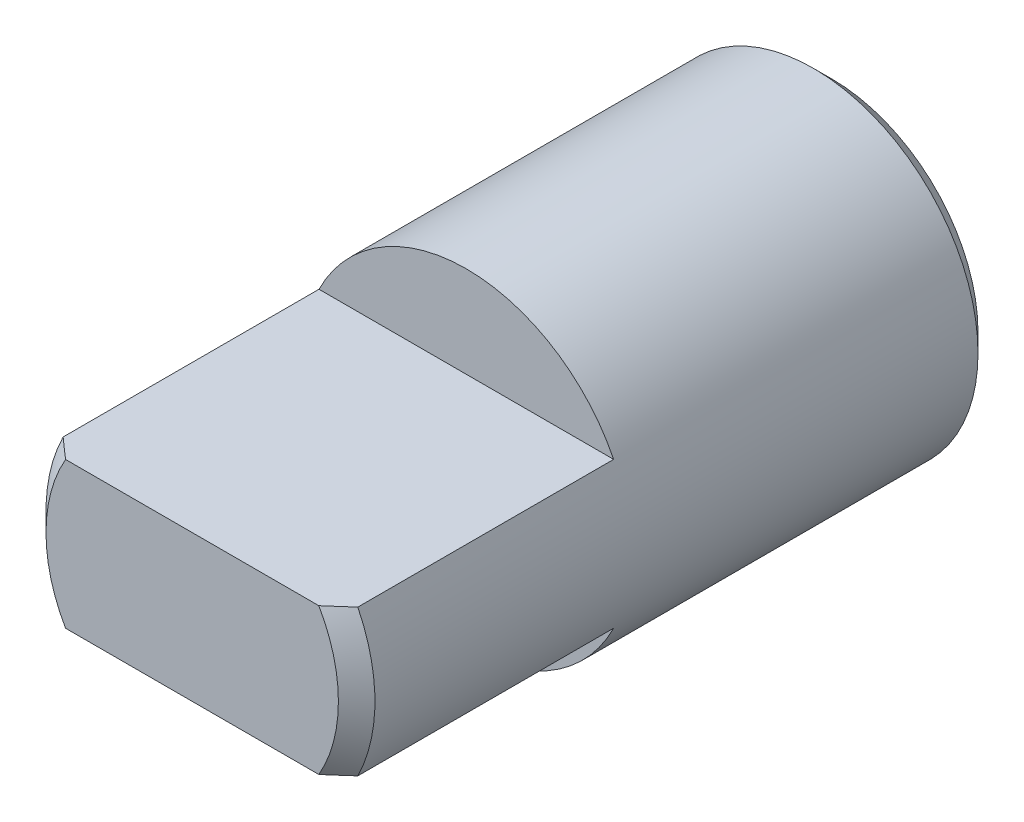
SolidWorks part; units mm, degrees
ref_plane "Face" through (0, 0, 0) normal (0, 0, 1) x (1, 0, 0)
ref_plane "Dessus" through (0, 0, 0) normal (0, 1, 0) x (1, 0, 0)
ref_plane "Droite" through (0, 0, 0) normal (1, 0, 0) x (0, 0, -1)
sketch "Esquisse1" plane through (0, 0, 0) normal (0, 0, 1) x (1, 0, 0)
  circle A0 centre (0, 0) radius 9
  dimension "D1" = 18
extrude "Extrusion1" add sketch "Esquisse1" along normal blind 35
chamfer "Chanfrein1" distance 1 angle 45 2 edges at (9, 0, 35) (9, 0, 0)
sketch "Esquisse3" plane through (0, 0, 0) normal (1, 0, 0) x (0, 0, -1)
  line L1 (-20, 4) -> (-35, 4)
  line L2 (-20, 4) -> (-20, 9)
  line L3 (-20, 9) -> (-35, 9)
  line L4 (-35, 4) -> (-35, 9)
  line L5 (-1, 9) -> (-34, 9) construction
  line L6 (0, 0) -> (-32.7044, 0) construction
  line L7 (-35, -4) -> (-35, -9)
  line L8 (-20, -9) -> (-35, -9)
  line L9 (-20, -4) -> (-20, -9)
  line L10 (-20, -4) -> (-35, -4)
  line L11 (-35, 8) -> (-35, -8) construction
  dimension "D1" = 8
  dimension "D2" = 15
extrude "Enlèv. mat.-Extru.1" cut sketch "Esquisse3" against normal through all and the other way through all
